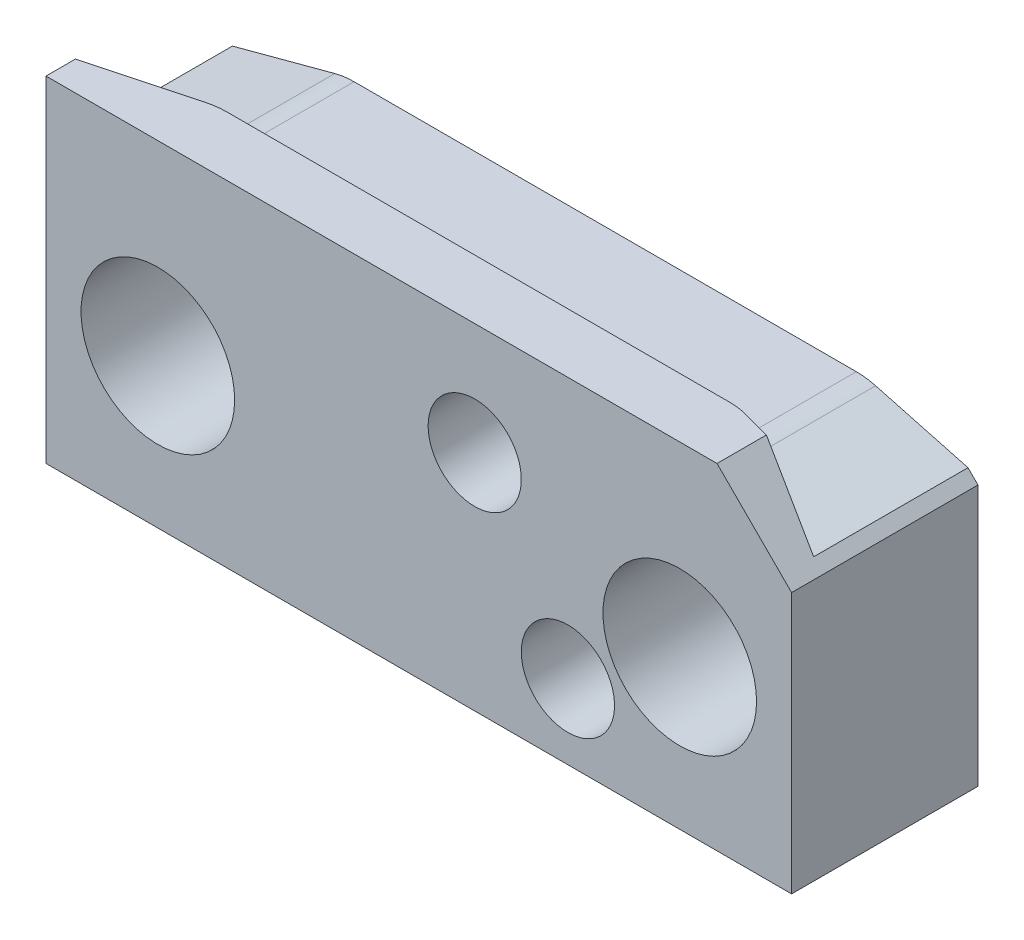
SolidWorks part; units mm, degrees
ref_plane "Front" through (0, 0, 0) normal (0, 0, 1) x (1, 0, 0)
ref_plane "Top" through (0, 0, 0) normal (0, 1, 0) x (1, 0, 0)
ref_plane "Right" through (0, 0, 0) normal (1, 0, 0) x (0, 0, -1)
sketch "Sketch1" plane through (0, 0, 0) normal (0, 0, 1) x (1, 0, 0)
  line L0 (-717.949, -76.5426) -> (-715.7872, -76.6445) construction
  line L1 (-719.656, -76.8985) -> (-762.434, -76.8985)
  line L2 (-709.295, -79.4507) -> (-709.295, -102.2985)
  line L3 (-709.295, -102.2985) -> (-772.795, -102.2985)
  line L4 (-772.795, -79.4507) -> (-772.795, -102.2985)
  line L5 (-717.949, -76.5426) -> (-715.7872, -76.6445) construction
  line L6 (-709.295, -79.4507) -> (-718.0125, -77.1148)
  line L7 (-764.0775, -77.1148) -> (-772.795, -79.4507)
  line L8 (-744.22, 149.225) -> (-744.22, -180.975) construction
  arc A0 (-764.0775, -77.1148) -> (-762.434, -76.8985) centre (-762.434, -83.2485) cw
  arc A1 (-718.0125, -77.1148) -> (-719.656, -76.8985) centre (-719.656, -83.2485) ccw
  point P0 (-709.295, -76.8985)
  point P3 (-772.795, -76.8985)
  point P14 (-763.27, -76.8985)
  point P17 (-718.82, -76.8985)
  dimension "D9" = 6.35
  dimension "D1" = 25.4
  dimension "D2" = 0.254
  dimension "D3" = 63.5
  dimension "D4" = 0.3559
  dimension "D5" = 9.525
  dimension "D6" = 15
  dimension "D7" = 9.525
  dimension "D8" = 15
  dimension "D10" = 34.925
  dimension "D11" = 42.778
extrude "Boss-Extrude1" add sketch "Sketch1" along normal blind 15.875 separate body
sketch "Sketch2" plane through (-709.295, 0, 0) normal (1, 0, 0) x (0, 0, -1)
  line L0 (-10.82, -81.661) -> (-10.82, -78.9217) construction
  line L1 (-10.82, -81.661) -> (-10.82, -78.9217) construction
  line L2 (-15.875, -76.8985) -> (0, -76.8985) construction
  line L3 (-15.875, -102.2985) -> (-10.82, -102.2985)
  line L4 (-15.875, -102.2985) -> (-15.875, -73.7235)
  line L5 (-15.875, -73.7235) -> (-10.82, -73.7235)
  line L6 (-10.82, -102.2985) -> (-10.82, -73.7235)
  dimension "D1" = 3.175
  dimension "D2" = 28.575
extrude "Boss-Extrude2" add sketch "Sketch2" against normal up to surface (63.5 mm away)
chamfer "Chamfer1" distance 9.525 angle 15 2 edges at (-772.795, -76.5871, 10.82) (-709.295, -76.5871, 10.82)
fillet "Fillet1" radius 6.35 2 edges at (-763.27, -75.3386, 10.82) (-718.82, -75.3386, 10.82)
sketch "Sketch3" plane through (0, 0, 15.875) normal (0, 0, 1) x (1, 0, 0)
  line L0 (-772.795, -89.5985) -> (-709.295, -89.5985) construction
  line L1 (-741.045, -101.5773) -> (-741.045, -117.4523) construction
  line L2 (-734.695, -101.5773) -> (-734.695, -117.4523)
  line L3 (-747.395, -101.5773) -> (-747.395, -117.4523)
  line L4 (-772.795, -79.4507) -> (-772.795, -102.2985) construction
  line L6 (-709.295, -102.2985) -> (-709.295, -79.4507) construction
  line L7 (-772.795, -102.2985) -> (-709.295, -102.2985) construction
  arc A0 (-734.695, -101.5773) -> (-747.395, -101.5773) centre (-741.045, -101.5773) ccw
  arc A1 (-747.395, -117.4523) -> (-734.695, -117.4523) centre (-741.045, -117.4523) ccw
  point P2 (-763.27, -89.5985)
  point P3 (-747.395, -89.5985)
  point P4 (-731.52, -89.5985)
  point P5 (-718.82, -89.5985)
  point P6 (-741.045, -89.5985)
  point P9 (-741.045, -109.5148)
  point P14 (-741.045, -89.5985)
  point P15 (-737.87, -89.5985)
  dimension "D1" = 12.7
  dimension "D4" = 12.7
  dimension "D5" = 15.875
  dimension "D2" = 12.7
hole_wizard "Hole1" positions "Point_Sketch" profile "Profil_Sketch" counterbore size "1/4" standard "ANSI Inch"
sketch "Point_Sketch" plane through (-776.1391, -88.5137, 15.875) normal (0, 0, -1) x (1, 0, 0)
  point P0 (12.8691, 1.0848)
sketch "Profil_Sketch" plane through (-763.27, -89.5985, 15.875) normal (1, 0, 0) x (0, -1, 0)
  line L0 (0, 0) -> (0, 15.875)
  line L1 (0, 15.875) -> (4.3688, 15.875)
  line L3 (4.3688, 15.875) -> (4.3688, 9.652)
  line L4 (4.3688, 9.652) -> (6.5405, 9.652)
  line L5 (6.5405, 9.652) -> (6.5405, 0)
  line L7 (6.5405, 0) -> (0, 0)
  line L11 (0, -6.35) -> (0, 107.95) construction
  dimension "Diameter" = 8.7376
  dimension "Thru Hole Depth" = 15.875
  dimension "L1" = 9.652
other "usin_LS160_.3125-18x.75-SHCS<1>"
hole_wizard "Hole11" positions "Point_Sketch1" profile "Profil_Sketch1" counterbore size "1/4" standard "ANSI Inch"
sketch "Point_Sketch1" plane through (-731.6891, -88.5137, 15.875) normal (0, 0, -1) x (1, 0, 0)
  point P0 (12.8691, 1.0848)
sketch "Profil_Sketch1" plane through (-718.82, -89.5985, 15.875) normal (1, 0, 0) x (0, -1, 0)
  line L0 (0, 0) -> (0, 15.875)
  line L1 (0, 15.875) -> (4.3688, 15.875)
  line L3 (4.3688, 15.875) -> (4.3688, 9.652)
  line L4 (4.3688, 9.652) -> (6.5405, 9.652)
  line L5 (6.5405, 9.652) -> (6.5405, 0)
  line L7 (6.5405, 0) -> (0, 0)
  line L11 (0, -6.35) -> (0, 107.95) construction
  dimension "Diameter" = 8.7376
  dimension "Thru Hole Depth" = 15.875
  dimension "L1" = 9.652
other "usin_LS160_.3125-18x.75-SHCS<2>"
hole_wizard "Hole12" positions "Point_Sketch2" profile "Profil_Sketch2" hole size "Ø0.15" standard "ISO"
sketch "Point_Sketch2" plane through (-724.6907, -85.1975, 0) normal (0, 0, 1) x (-1, 0, 0)
  point P0 (3.6543, 10.7509)
  point P2 (11.5918, -1.9491)
sketch "Profil_Sketch2" plane through (-728.345, -95.9485, 0) normal (1, 0, 0) x (0, 1, 0)
  line L0 (0, 0) -> (0, 15.875)
  line L1 (0, 15.875) -> (3.9687, 15.875)
  line L2 (3.9687, 15.875) -> (3.9687, 0)
  line L5 (3.9687, 0) -> (0, 0)
  line L11 (0, -6.35) -> (0, 107.95) construction
  dimension "Diameter" = 7.9375
  dimension "Thru Hole Depth" = 15.875
other "usin_DL090_.3125 x 1.25 DOWEL PIN<1>"
chamfer "Chamfer2" distance 6.35 angle 45 1 edges at (-709.295, -73.7235, 14.6236)
